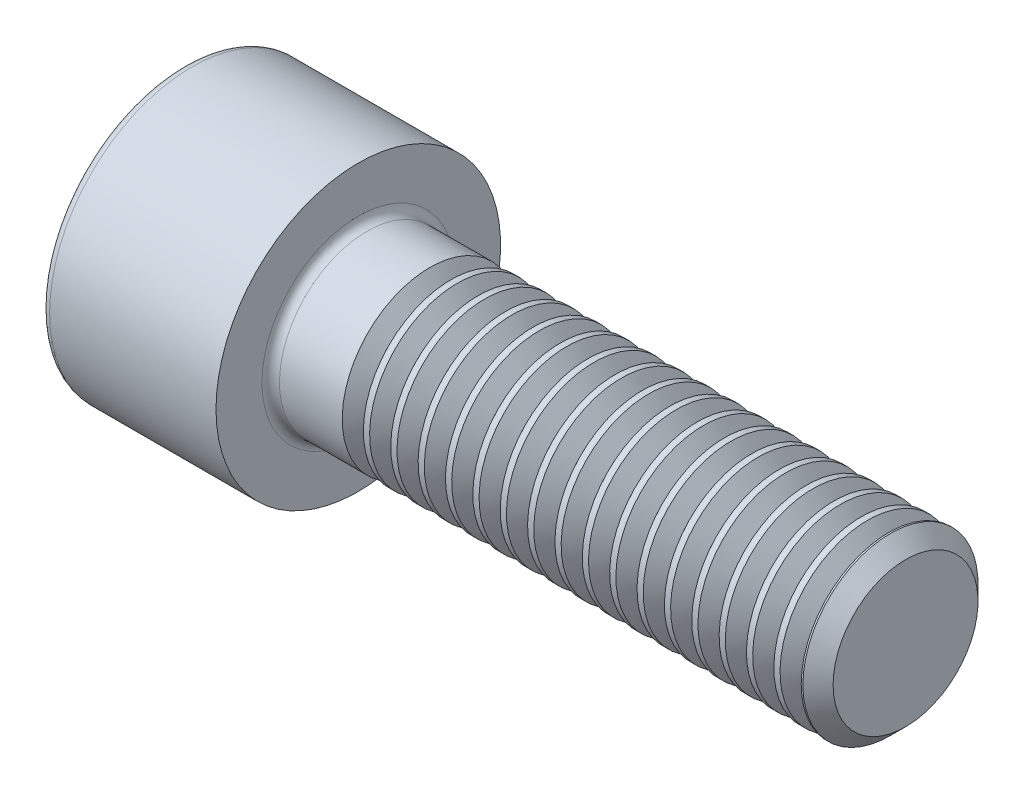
SolidWorks part; units mm, degrees
ref_plane "Plane1" through (0, 0, 0) normal (0, 0, 1) x (1, 0, 0)
ref_plane "Plane2" through (0, 0, 0) normal (0, 1, 0) x (1, 0, 0)
ref_plane "Plane3" through (0, 0, 0) normal (1, 0, 0) x (0, 0, -1)
revolve "Base-Revolve" add sketch "BodySke"
sketch "BodySke" plane through (0, 0, 0) normal (0, 0, 1) x (1, 0, 0)
  line L0 (0, 0) -> (0, 6.5)
  line L1 (0, 6.5) -> (8, 6.5)
  line L2 (8, 6.5) -> (8, 4)
  line L3 (8, 4) -> (32.3095, 4)
  line L4 (33, 3.3095) -> (33, 0)
  line L5 (33, 0) -> (0, 0)
  line L6 (-31.75, 0) -> (127, 0) construction
  line L8 (33, 3.3095) -> (32.3095, 4)
  line L10 (33, -3.3095) -> (32.3095, -4) construction
  line L11 (9.25, 9.525) -> (9.25, 3.175) construction
  line L12 (3, 9.525) -> (3, 3.175) construction
  line L13 (-27, 9.525) -> (-27, 3.175) construction
  dimension "Diameter" = 8
  dimension "Head_ht" = 8
  dimension "Length" = 25
  dimension "Body_ch_ang" = 45
  dimension "Head_dia" = 13
  dimension "Minor_dia" = 6.619
  dimension "Advance" = 1.25
  dimension "Thread_nom" = 30
  dimension "Thread_length" = 60
fillet "Fillet1" radius 0.4 1 edges at (8, 0, 4)
fillet "Fillet2" radius 0.4 1 edges at (0, 0, 6.5)
sketch "Sketch2" plane through (0, 0, 0) normal (0, 0, 1) x (1, 0, 0)
  line L0 (0, 3.0475) -> (4, 3.0475)
  line L1 (4, 3.0475) -> (5.7595, 0)
  line L2 (-31.75, 0) -> (127, 0) construction
  line L3 (5.7595, 0) -> (0, 0)
  line L4 (0, 0) -> (0, 3.0475)
  line L6 (0, 0) -> (47.625, 0) construction
  dimension "D1" = 3.0475
  dimension "D2" = 60
  dimension "Depth" = 4
revolve "Hex-PreBroach" cut sketch "Sketch2" angle 360 about L6
sketch "Sketch3" plane through (0, 0, 0) normal (-1, 0, 0) x (0, 0.5, 0.866)
  line L0 (1.7595, 3.0475) -> (-1.7595, 3.0475)
  line L1 (-1.7595, 3.0475) -> (-3.5189, 0)
  line L2 (1.7595, 3.0475) -> (3.5189, 0)
  line L3 (1.7595, -3.0475) -> (3.5189, 0)
  line L4 (1.7595, -3.0475) -> (-1.7595, -3.0475)
  line L5 (-1.7595, -3.0475) -> (-3.5189, 0)
  dimension "D1" = 3.0475
  dimension "D2" = 3.0475
  dimension "Hex_size" = 6.095
extrude "Hex" cut sketch "Sketch3" against normal blind 4
sketch "ThdSchSke" plane through (0, 0, 0) normal (0, 0, 1) x (1, 0, 0)
  line L0 (11.75, -3.3095) -> (11.2665, -4)
  line L1 (11.75, -3.3095) -> (12.2335, -4)
  line L2 (12.2335, -4) -> (12.2335, -5)
  line L3 (-3.175, 0) -> (5.1513, 0) construction
  line L4 (0, 6.1) -> (0, -6.1) construction
  line L5 (12.2335, -5) -> (11.2665, -5)
  line L6 (11.2665, -5) -> (11.2665, -4)
  dimension "Thread_minor" = 6.619
  dimension "Diameter" = 8
  dimension "Start" = 11.75
  dimension "SideAngle" = 55
  dimension "VeeAngle" = 70
  dimension "Overcut" = 10
revolve "ThreadSchematic" cut sketch "ThdSchSke" angle 360 about L3
pattern_linear "ThdSchPat" count 17 spacing 1.25 along (1, 0, 0) of "ThreadSchematic"
equation "\"D2@Sketch3\" = \"Hex_size@Sketch3\" / 2"
equation "\"D1@Sketch3\" = \"Hex_size@Sketch3\" / 2"
equation "\"D1@Sketch2\" = \"Hex_size@Sketch3\" / 2"
equation "\"Thread_minor@ThreadCosmetic\"  =  \"Minor_dia@BodySke\""
equation "\"Depth@Sketch2\" =  \"Key_eng@Hex\""
equation "\"Thread_length@ThreadCosmetic\" = ((sgn( (\"Length@BodySke\" - \"Advance@BodySke\" * 3.0) - \"Thread_nom@BodySke\" )-1)*( (\"Length@BodySke\" - \"Advance@BodySke\" * 3.0) - \"Thread_nom@BodySke\" ))/-2+ \"Thread_no"
equation "\"Thread_minor@ThdSchSke\" = \"Minor_dia@BodySke\""
equation "\"Diameter@ThdSchSke\" = \"Diameter@BodySke\""
equation "\"Overcut@ThdSchSke\" = \"Diameter@BodySke\" * 1.25"
equation "\"Start@ThdSchSke\" = \"Head_ht@BodySke\" + \"Length@BodySke\" - \"Thread_length@ThreadCosmetic\"  '---Non-countersunk---"
equation "\"Num_threads@ThdSchPat\" = int( \"Thread_length@ThreadCosmetic\" / \"Advance@BodySke\" + 0.999 )  + 1"
equation "\"Advance@ThdSchPat\" = \"Thread_length@ThreadCosmetic\" /  (\"Num_threads@ThdSchPat\" - 1) 'relax it"
equation "\"Num_threads@ThdSchPat\" = \"Num_threads@ThdSchPat\" - sgn( \"Num_threads@ThdSchPat\" - 1) '---chamfered tips only---"
